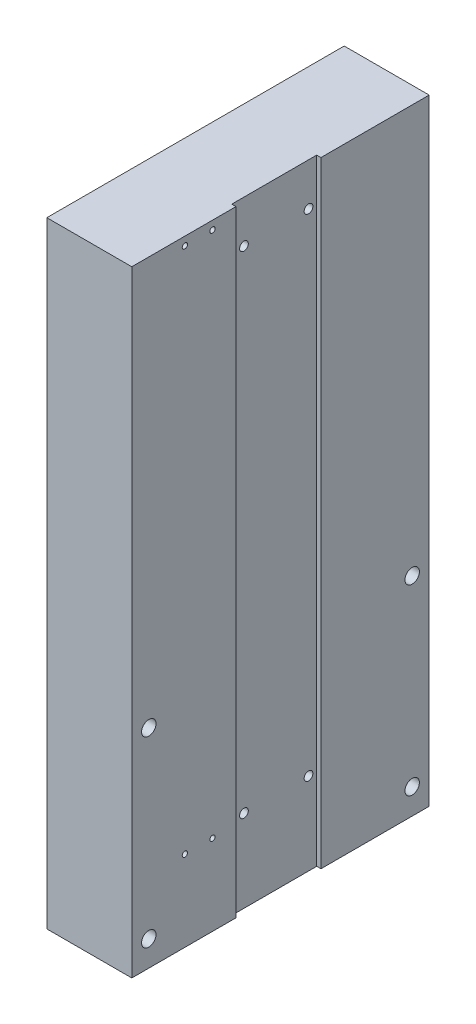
SolidWorks part; units mm, degrees
ref_plane "Plan1" through (0, 0, 0) normal (0, 0, 1) x (1, 0, 0)
ref_plane "Plan2" through (0, 0, 0) normal (0, 1, 0) x (1, 0, 0)
ref_plane "Plan3" through (0, 0, 0) normal (1, 0, 0) x (0, 0, -1)
sketch "Esquisse1" plane through (0, 0, 0) normal (1, 0, 0) x (0, 0, -1)
  line L1 (-35, 145) -> (35, 145)
  line L2 (-35, 145) -> (-35, 0)
  line L3 (-35, 0) -> (35, 0)
  line L4 (35, 145) -> (35, 0)
  dimension "D1" = 70
  dimension "D2" = 145
extrude "Boss.-Extru.1" add sketch "Esquisse1" against normal blind 20
sketch "Esquisse9" plane through (0, 0, 0) normal (0, -1, 0) x (1, 0, 0)
  line L0 (0, -50) -> (0, 50) construction
  line L1 (-1, 10.475) -> (0, 10.475)
  line L2 (-1, 10.475) -> (-1, -9.525)
  line L3 (-1, -9.525) -> (0, -9.525)
  line L4 (0, 10.475) -> (0, -9.525)
  line L5 (50, 0) -> (-50, 0) construction
  dimension "D1" = 9.525
  dimension "D2" = 20
  dimension "D3" = 1
extrude "Enlèv. mat.-Extru.2" cut sketch "Esquisse9" against normal through all
sketch "Esquisse2" plane through (-20, 0, 0) normal (-1, 0, 0) x (0, 0, 1)
  line L8 (27, 8) -> (27, 137)
  line L9 (27, 137) -> (-27, 137)
  line L10 (-27, 137) -> (-27, 8)
  line L11 (-27, 8) -> (27, 8)
  line L12 (27, 13) -> (27, 132)
  line L13 (22, 137) -> (-22, 137)
  line L14 (-27, 132) -> (-27, 13)
  line L15 (-22, 8) -> (22, 8)
  arc A0 (-27, 13) -> (-22, 8) centre (-22, 13) ccw
  arc A1 (22, 8) -> (27, 13) centre (22, 13) ccw
  arc A2 (27, 132) -> (22, 137) centre (22, 132) ccw
  arc A3 (-22, 137) -> (-27, 132) centre (-22, 132) ccw
  dimension "D2" = 5
  dimension "D1" = 8
extrude "Enlèv. mat.-Extru.1" cut sketch "Esquisse2" against normal blind 12
hole_wizard "Chambrage pour vis à tête hexagonale M31" positions "Esquisse4" profile "Esquisse3" counterbore size "M3" standard "ISO"
sketch "Esquisse4" plane through (-20, 0, 0) normal (-1, 0, 0) x (0, 0, 1)
  line L0 (35, 0) -> (-35, 0) construction
  line L1 (0, 66.3639) -> (0, -10.9984) construction
  line L3 (0, -50) -> (0, 50) construction
  line L4 (-35, 0) -> (-35, 145) construction
  point P0 (-31, 6)
  point P2 (-31, 49)
  point P13 (31, 49)
  point P14 (31, 6)
  dimension "D1" = 6
  dimension "D2" = 43
  dimension "D3" = 62
  dimension "D4" = 4
sketch "Esquisse3" plane through (-20, 6, -31) normal (0, 1, 0) x (0, 0, 1)
  line L0 (0, 0) -> (0, 20)
  line L1 (0, 20) -> (1.7, 20)
  line L3 (1.7, 20) -> (1.7, 3.4)
  line L4 (1.7, 3.4) -> (3.25, 3.4)
  line L5 (3.25, 3.4) -> (3.25, 0)
  line L7 (3.25, 0) -> (0, 0)
  line L11 (0, -6.35) -> (0, 107.95) construction
  dimension "Diamètre du perçage jusqu'au prochain" = 3.4
  dimension "Profondeur du perçage jusqu'au prochain" = 20
  dimension "Diamètre du chambrage" = 6.5
  dimension "Profondeur du chambrage" = 3.4
hole_wizard "Trou taraudé M2.51" positions "Esquisse6" profile "Esquisse5" tap size "M2.5" standard "ISO"
sketch "Esquisse6" plane through (-1, 38.3578, -1.5073) normal (1, 0, 0) x (0, 0, -1)
  line L0 (-1.5073, 149.0441) -> (-1.5073, -38.3578) construction
  line L2 (-1.5073, 11.6422) -> (-1.5073, -88.3578) construction
  line L3 (33.4927, 106.6422) -> (8.0177, 106.6422) construction
  point P0 (6.0927, 96.6422)
  point P2 (6.0927, -18.9578)
  point P11 (-9.1073, -18.9578)
  point P12 (-9.1073, 96.6422)
  dimension "D1" = 15.2
  dimension "D2" = 10
  dimension "D3" = 115.6
sketch "Esquisse5" plane through (-1, 135, -7.6) normal (0, 1, 0) x (0, 0, -1)
  line L0 (0, 0) -> (0, 19)
  line L1 (0, 19) -> (1.025, 19)
  line L2 (1.025, 19) -> (1.025, 0)
  line L5 (1.025, 0) -> (0, 0)
  line L11 (0, -6.35) -> (0, 107.95) construction
  dimension "Diamètre du trou pour taraudage jusqu'au prochain" = 2.05
  dimension "Profondeur du trou pour taraudage jusqu'au prochain" = 19
hole_wizard "Trou taraudé M1.61" positions "Esquisse8" profile "Esquisse7" tap size "M1.6" standard "ISO"
sketch "Esquisse8" plane through (0, 0, 0) normal (1, 0, 0) x (0, 0, -1)
  line L0 (0, 50) -> (0, -50) construction
  circle A0 centre (-7.6, 135) radius 1.025 construction
  point P0 (-16, 143)
  point P2 (-22.5, 143)
  point P4 (-16, 19)
  point P6 (-22.5, 19)
  dimension "D3" = 8
  dimension "D4" = 116
  dimension "D1" = 16
  dimension "D2" = 6.5
sketch "Esquisse7" plane through (0, 143, 16) normal (0, 1, 0) x (0, 0, -1)
  line L0 (0, 0) -> (0, 6.3755)
  line L1 (0, 6.3755) -> (0.625, 6)
  line L2 (0.625, 6) -> (0.625, 0)
  line L5 (0.625, 0) -> (0, 0)
  line L10 (0, 6.3755) -> (-0.625, 6) construction
  line L11 (0, -6.35) -> (0, 107.95) construction
  dimension "Diamètre du trou pour taraudage" = 1.25
  dimension "Profondeur du trou pour taraudage" = 6
  dimension "Angle de pointe" = 118
